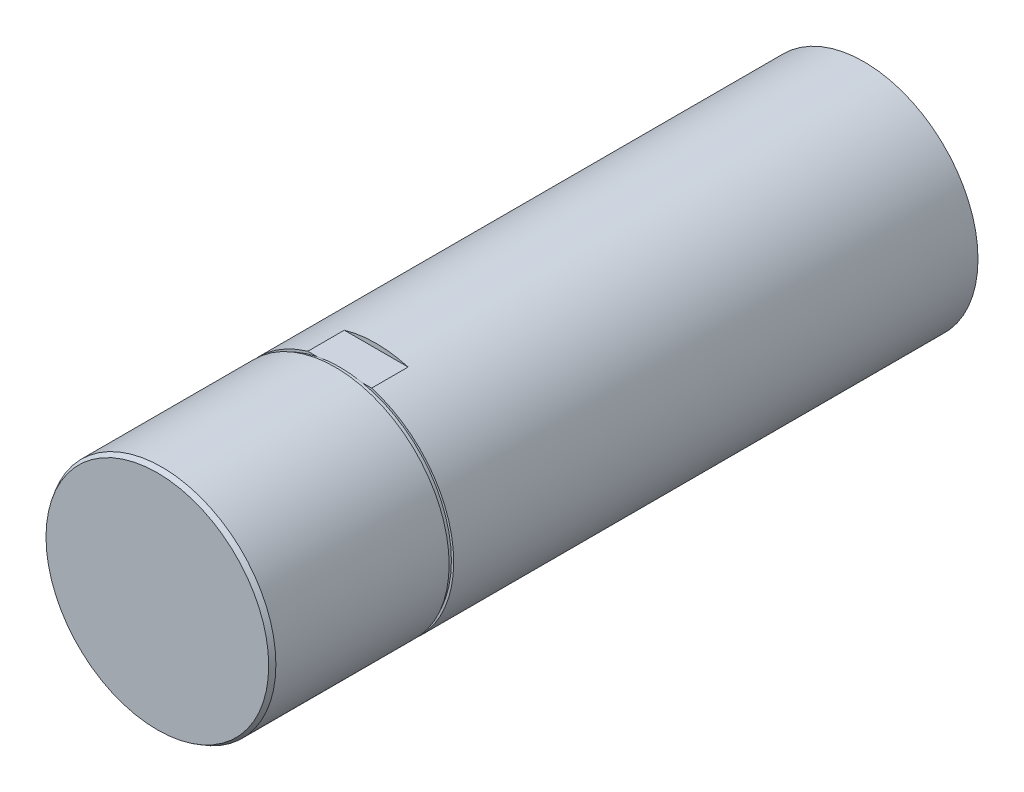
SolidWorks part; units mm, degrees
ref_plane "Front Plane" through (0, 0, 0) normal (0, 0, 1) x (1, 0, 0)
ref_plane "Top Plane" through (0, 0, 0) normal (0, 1, 0) x (1, 0, 0)
ref_plane "Right Plane" through (0, 0, 0) normal (1, 0, 0) x (0, 0, -1)
sketch "Sketch1" plane through (0, 0, 0) normal (0, 0, 1) x (1, 0, 0)
  circle A0 centre (0, 0) radius 25
  dimension "D1" = 50
extrude "STROKE" add sketch "Sketch1" against normal blind 100
sketch "Sketch2" plane through (0, 0, 0) normal (0, 0, 1) x (1, 0, 0)
  circle A0 centre (0, 0) radius 25
  dimension "D1" = 50
extrude "L2" add sketch "Sketch2" along normal blind 15
ref_plane "Plane1" through (0, 0, 15) normal (0, 0, 1) x (1, 0, 0)
sketch "Sketch3" plane through (0, 0, 15) normal (0, 0, 1) x (1, 0, 0)
  circle A0 centre (0, 0) radius 25
  dimension "D1" = 50
extrude "L3" add sketch "Sketch3" along normal blind 40
chamfer "Chamfer2" distance 1 angle 30 1 edges at (25, 0, 55)
sketch "Sketch5" plane through (0, 0, 15) normal (0, 0, 1) x (1, 0, 0)
  circle A0 centre (0, 0) radius 25
  circle A1 centre (0, 0) radius 24.5
  circle A4 centre (0, 0) radius 25 construction
  dimension "D1" = 50
  dimension "D2" = 49
extrude "U/C" cut sketch "Sketch5" along normal blind 1
sketch "Sketch6" plane through (0, 0, 0) normal (1, 0, 0) x (0, 0, -1)
  line L0 (-55, 24.4226) -> (-55, -24.4226) construction
  line L1 (-15, 25.5) -> (-7, 25.5)
  line L2 (-15, -24) -> (-15, -25.5)
  line L3 (-15, 24) -> (-7, 24)
  line L4 (-7, 25.5) -> (-7, 24)
  line L5 (-15, -24) -> (-7, -24)
  line L6 (-15, 25.5) -> (-15, 24)
  line L7 (-15, -25.5) -> (-7, -25.5)
  line L8 (-7, -24) -> (-7, -25.5)
  line L9 (100, -25) -> (100, 25) construction
  line L10 (100, 0) -> (-15, 0) construction
  line L12 (100, 0) -> (-15, 0) construction
  dimension "D1" = 8
  dimension "D2" = 48
  dimension "D3" = 24
  dimension "D4" = 40
  dimension "D5" = 51
  dimension "D6" = 50
  dimension "D7" = 25.5
extrude "A/F" cut sketch "Sketch6" against normal mid plane 21
equation "\"D2@Sketch5\" = \"D1@Sketch5\" - 1"
equation "\"D5@Sketch6\" = \"D2@Sketch6\"+3"
equation "\"D3@Sketch6\" = \"D2@Sketch6\" / 2"
equation "\"D2@Sketch6\" = \"D6@Sketch6\"-2"
equation "\"D7@Sketch6\" = \"D5@Sketch6\"/2"
